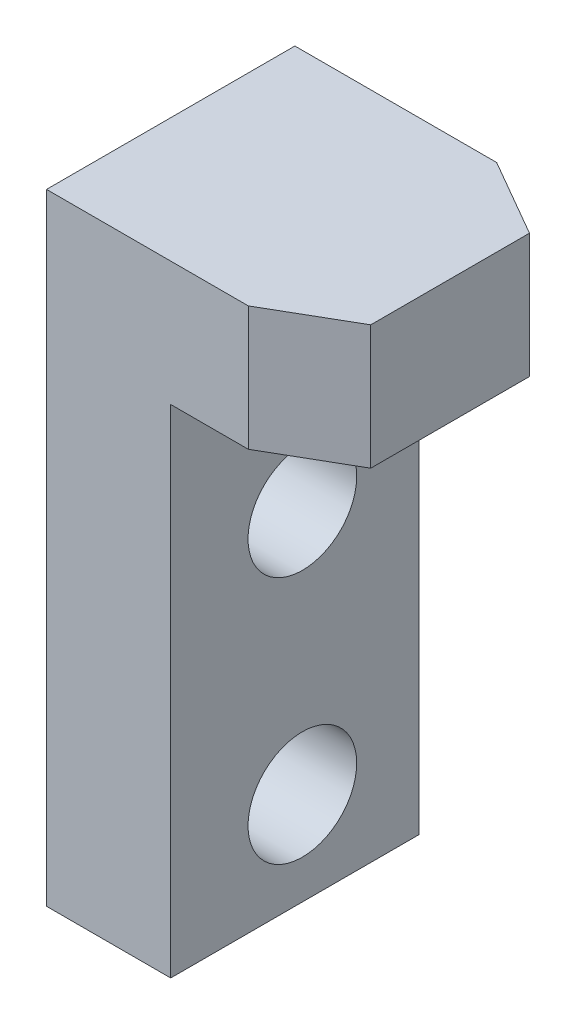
SolidWorks part; units mm, degrees
ref_plane "Plan de face" through (0, 0, 0) normal (0, 0, 1) x (1, 0, 0)
ref_plane "Plan de dessus" through (0, 0, 0) normal (0, 1, 0) x (1, 0, 0)
ref_plane "Plan de droite" through (0, 0, 0) normal (1, 0, 0) x (0, 0, -1)
sketch "Esquisse1" plane through (0, 0, 0) normal (0, 0, 1) x (1, 0, 0)
  line L1 (0, 0) -> (9, 0)
  line L2 (0, 0) -> (0, -20)
  line L3 (0, -20) -> (4, -20)
  line L4 (9, 0) -> (9, -4)
  line L7 (9, -4) -> (4, -4)
  line L8 (4, -20) -> (4, -4)
  dimension "D1" = 9
  dimension "D2" = 4
  dimension "D3" = 4
  dimension "D4" = 20
extrude "Boss.-Extru.1" add sketch "Esquisse1" along normal blind 8
chamfer "Chanfrein1" distance 2.5 angle 30 2 edges at (9, -2, 0) (9, -2, 8)
sketch "Esquisse2" plane through (4, 0, 0) normal (1, 0, 0) x (0, 0, -1)
  line L0 (-8, -20) -> (0, -20) construction
  circle A0 centre (-3.759, -17) radius 1.75
  circle A1 centre (-3.759, -9) radius 1.75
  point P4 (-4, -20)
  dimension "D1" = 3.5
  dimension "D2" = 3.5
  dimension "D3" = 8
  dimension "D4" = 3
extrude "Enlèv. mat.-Extru.1" cut sketch "Esquisse2" against normal through all
